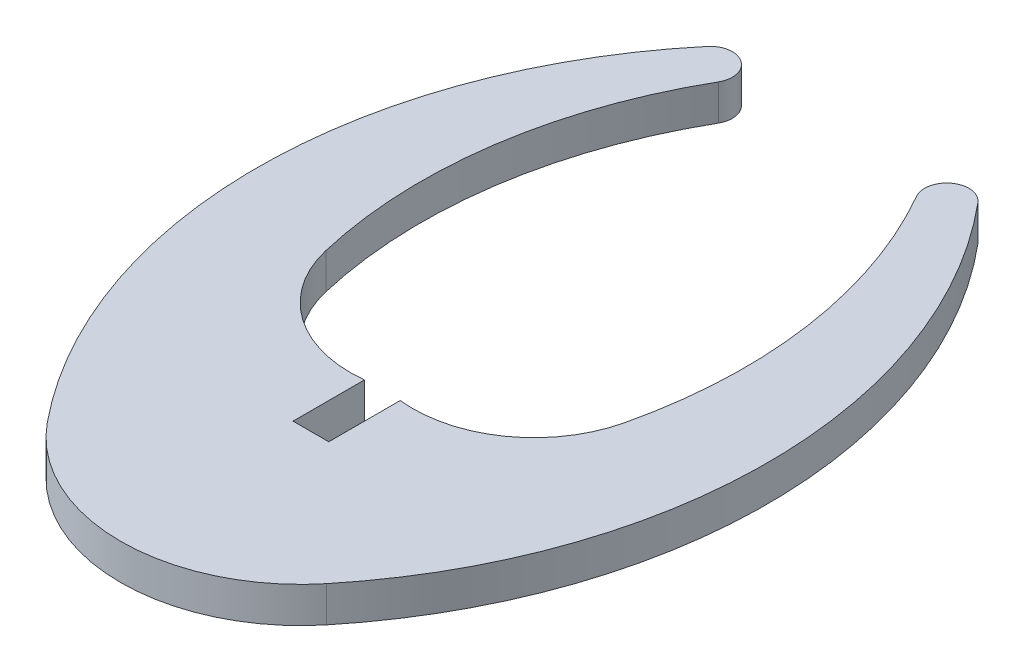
SolidWorks part; units mm, degrees
ref_plane "Front" through (0, 0, 0) normal (0, 0, 1) x (1, 0, 0)
ref_plane "Top" through (0, 0, 0) normal (0, 1, 0) x (1, 0, 0)
ref_plane "Right" through (0, 0, 0) normal (1, 0, 0) x (0, 0, -1)
body saved out of another part "Stock-Grillo Piezas-1"
